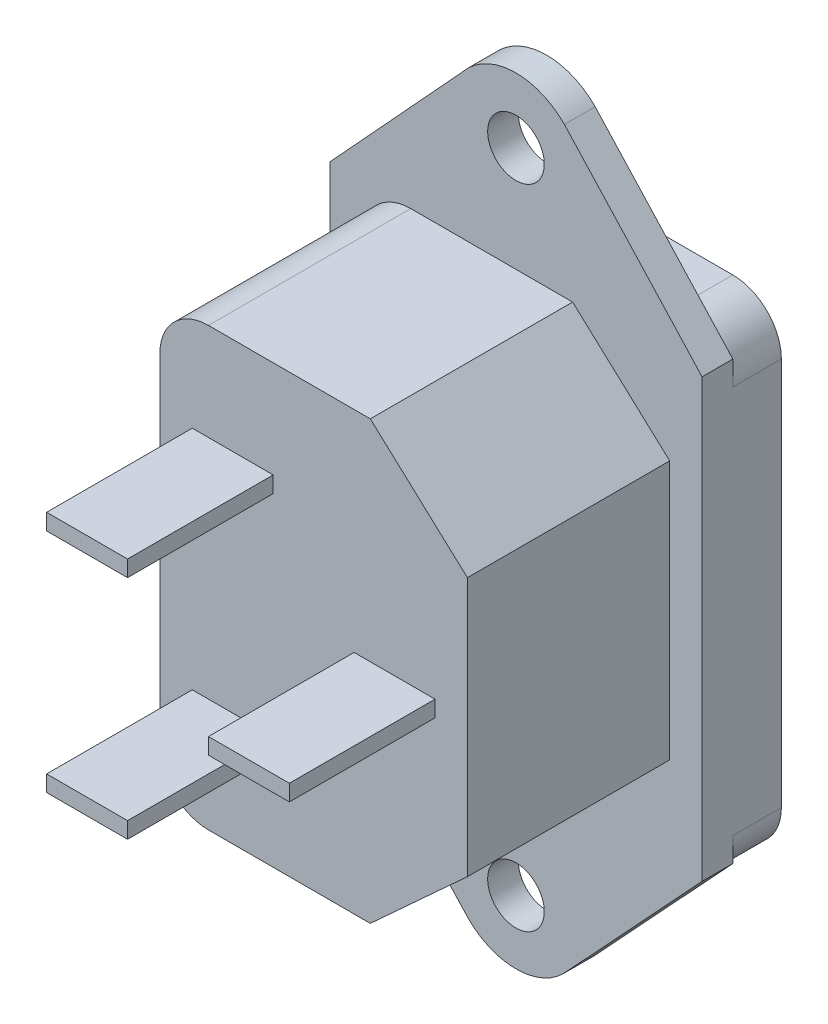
SolidWorks part; units mm, degrees
ref_plane "Спереди" through (0, 0, 0) normal (0, 0, 1) x (1, 0, 0)
ref_plane "Сверху" through (0, 0, 0) normal (0, 1, 0) x (1, 0, 0)
ref_plane "Справа" through (0, 0, 0) normal (1, 0, 0) x (0, 0, -1)
sketch "Эскиз1" plane through (0, 0, 0) normal (0, 0, 1) x (1, 0, 0)
  line L0 (11.5, 13.5) -> (11.5, -13.5)
  line L1 (-11.5, -13.5) -> (-11.5, 13.5)
  line L2 (-11.5, -13.5) -> (-2.9297, -22.7225)
  line L3 (11.5, -13.5) -> (2.9307, -22.7224)
  line L4 (11.5, 13.5) -> (2.992, 22.7516)
  line L5 (-11.5, 13.5) -> (-2.9297, 22.8187)
  arc A2 (-2.9297, 22.8187) -> (2.992, 22.7516) centre (-0.0024, 19.8242) cw
  arc A3 (2.9307, -22.7224) -> (-2.9297, -22.7225) centre (0.0004, -19.7923) cw
  point P0 (0, 0)
extrude "Бобышка-Вытянуть1" add sketch "Эскиз1" along normal blind 1.9
sketch "Эскиз2" plane through (0, 0, 0) normal (0, 0, -1) x (-1, 0, 0)
  circle A0 centre (0, 20) radius 1.75
  circle A1 centre (0, -20) radius 1.75
extrude "Вырез-Вытянуть1" cut sketch "Эскиз2" against normal up to surface (1.9 mm away)
sketch "Эскиз3" plane through (0, 0, 1.9) normal (0, 0, 1) x (1, 0, 0)
  line L0 (-9.5, -10.5) -> (-9.5, 10.5)
  line L1 (3.5, -13.5) -> (-6.5, -13.5)
  line L2 (3.5, 13.5) -> (-6.5, 13.5)
  line L3 (9.5, 8) -> (9.5, -8)
  line L4 (3.5, 13.5) -> (9.5, 8)
  line L5 (3.5, -13.5) -> (9.5, -8)
  arc A0 (-9.5, 10.5) -> (-6.5, 13.5) centre (-6.5, 10.5) cw
  arc A1 (-6.5, -13.5) -> (-9.5, -10.5) centre (-6.5, -10.5) cw
extrude "Бобышка-Вытянуть2" add sketch "Эскиз3" along normal blind 12.5
sketch "Эскиз9" plane through (0, 0, 14.4) normal (0, 0, 1) x (1, 0, 0)
  line L1 (-7.5, -6.5) -> (-2.5, -6.5)
  line L2 (-7.5, -6.5) -> (-7.5, -7.5)
  line L3 (-7.5, -7.5) -> (-2.5, -7.5)
  line L4 (-2.5, -6.5) -> (-2.5, -7.5)
  line L5 (-7.5, 7.5) -> (-2.5, 7.5)
  line L6 (-7.5, 7.5) -> (-7.5, 6.5)
  line L7 (-7.5, 6.5) -> (-2.5, 6.5)
  line L8 (-2.5, 7.5) -> (-2.5, 6.5)
  line L9 (2.5, -0.5) -> (7.5, -0.5)
  line L10 (2.5, -0.5) -> (2.5, 0.5)
  line L11 (2.5, 0.5) -> (7.5, 0.5)
  line L12 (7.5, -0.5) -> (7.5, 0.5)
extrude "Бобышка-Вытянуть6" add sketch "Эскиз9" along normal blind 9 contours L7 L8 L5 L6 | L10 L11 L12 L9 | L2 L3 L4 L1
sketch "Эскиз13" plane through (0, 0, 0) normal (0, 0, -1) x (-1, 0, 0)
  line L0 (-8.5, 15) -> (8.5, 15)
  line L1 (-8.5, -15) -> (8.5, -15)
  line L2 (11.5, 12) -> (11.5, -12)
  line L3 (-11.5, 12) -> (-11.5, -12)
  arc A0 (-8.5, -15) -> (-11.5, -12) centre (-8.5, -12) cw
  arc A1 (11.5, -12) -> (8.5, -15) centre (8.5, -12) cw
  arc A2 (8.5, 15) -> (11.5, 12) centre (8.5, 12) cw
  arc A3 (-11.5, 12) -> (-8.5, 15) centre (-8.5, 12) cw
extrude "Бобышка-Вытянуть7" add sketch "Эскиз13" along normal blind 3 contours A3 L0 A2 L2 A1 L1 A0 L3
sketch "Эскиз15" plane through (0, 0, -3) normal (0, 0, -1) x (-1, 0, 0)
  line L0 (8, 10) -> (8, -10)
  line L1 (-8, 7) -> (-8, -7)
  line L2 (6, 12) -> (-3, 12)
  line L3 (6, -12) -> (-3, -12)
  line L4 (-3, 12) -> (-8, 7)
  line L5 (-3, -12) -> (-8, -7)
  arc A0 (6, -12) -> (8, -10) centre (6, -10) ccw
  arc A1 (8, 10) -> (6, 12) centre (6, 10) ccw
extrude "Вырез-Вытянуть2" cut sketch "Эскиз15" against normal blind 17
